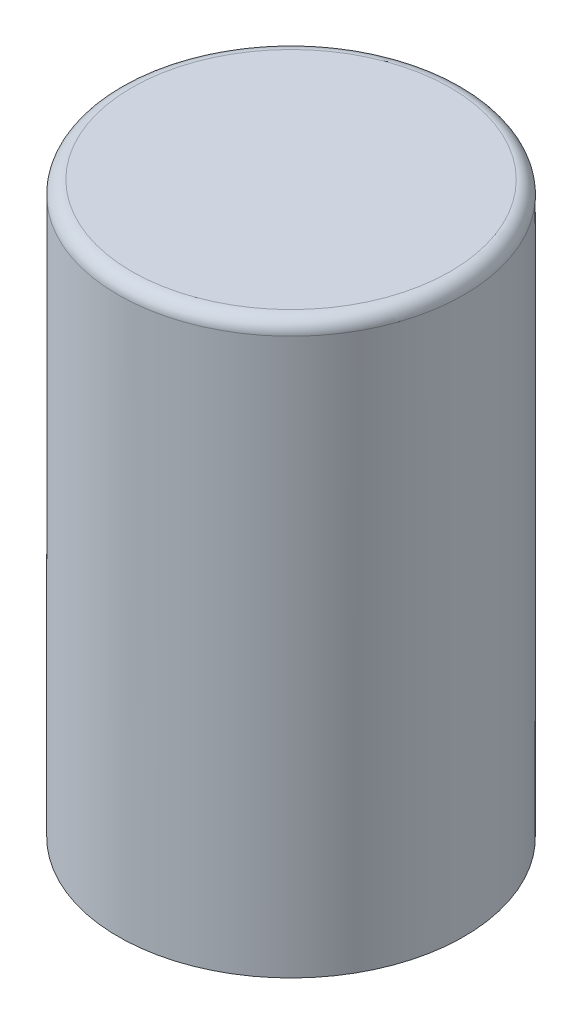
SolidWorks part; units mm, degrees
ref_plane "Front Plane" through (0, 0, 0) normal (0, 0, 1) x (1, 0, 0)
ref_plane "Top Plane" through (0, 0, 0) normal (0, 1, 0) x (1, 0, 0)
ref_plane "Right Plane" through (0, 0, 0) normal (1, 0, 0) x (0, 0, -1)
body saved out of another part "Stock-PSU-1"
scale "Scale1" scale about centroid uniform scaling yes scale factor 0.35
